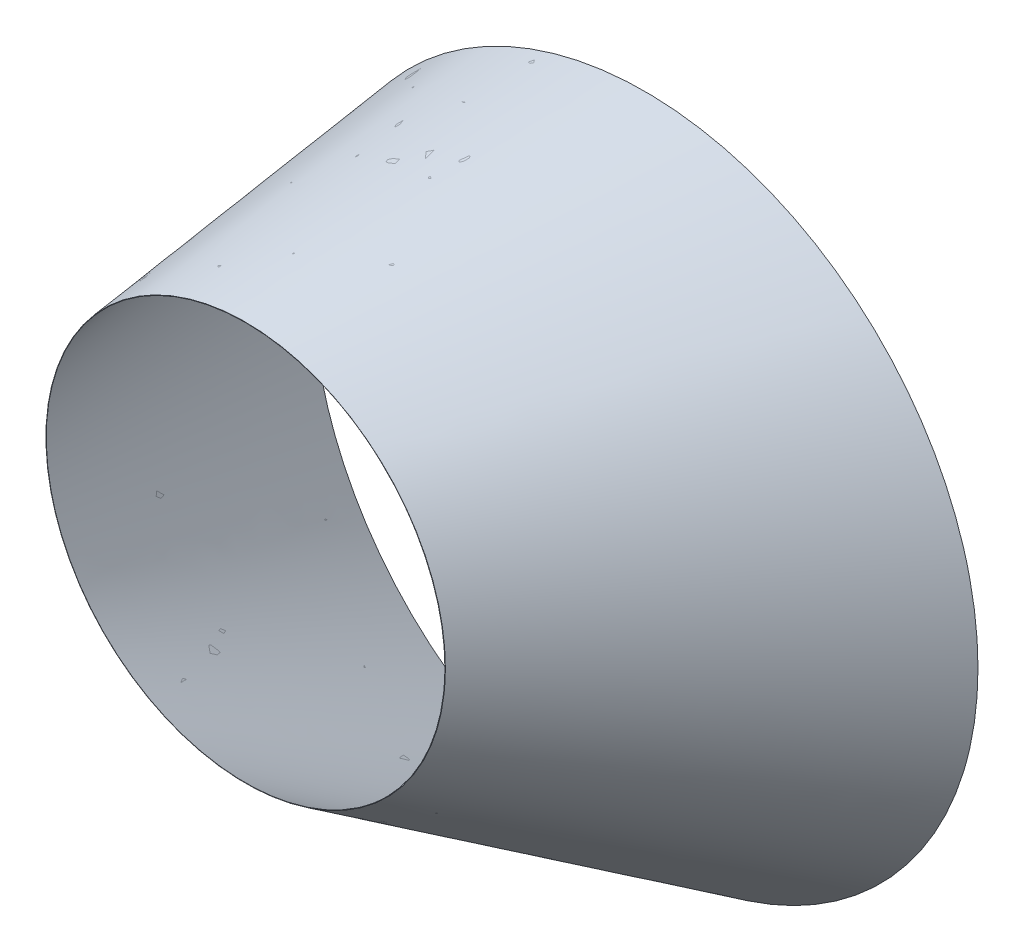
SolidWorks part; units mm, degrees
ref_plane "前视基准面" through (0, 0, 0) normal (0, 0, 1) x (1, 0, 0)
ref_plane "上视基准面" through (0, 0, 0) normal (0, 1, 0) x (1, 0, 0)
ref_plane "右视基准面" through (0, 0, 0) normal (1, 0, 0) x (0, 0, -1)
sketch "草图1" plane through (0, 0, 0) normal (0, 0, 1) x (1, 0, 0)
  line L0 (0, 0) -> (-1000, 0) construction
  circle A0 centre (0, 0) radius 1000
  dimension "D" = 2000
sketch "草图3" plane through (0, 0, 0) normal (0, 1, 0) x (1, 0, 0)
  line L0 (-1000, -800) -> (200, -800)
  line L1 (-1000, -2000) -> (-1000, 0) construction
  line L2 (-1000, 0) -> (1000, 0) construction
  line L3 (1000, 0) -> (-1000, -2000) construction
  line L4 (-1000, 0) -> (1000, 0) construction
  dimension "d" = 1200
  dimension "h" = 800
sketch "草图2" plane through (0, 0, 0) normal (0, 1, 0) x (1, 0, 0)
  point P0 (-1000, -2000)
loft "放样1" add profiles "草图1", "草图2"
extrude "切除-拉伸1" cut sketch "草图3" against normal through all and the other way through all flip side to cut
shell "抽壳1"
